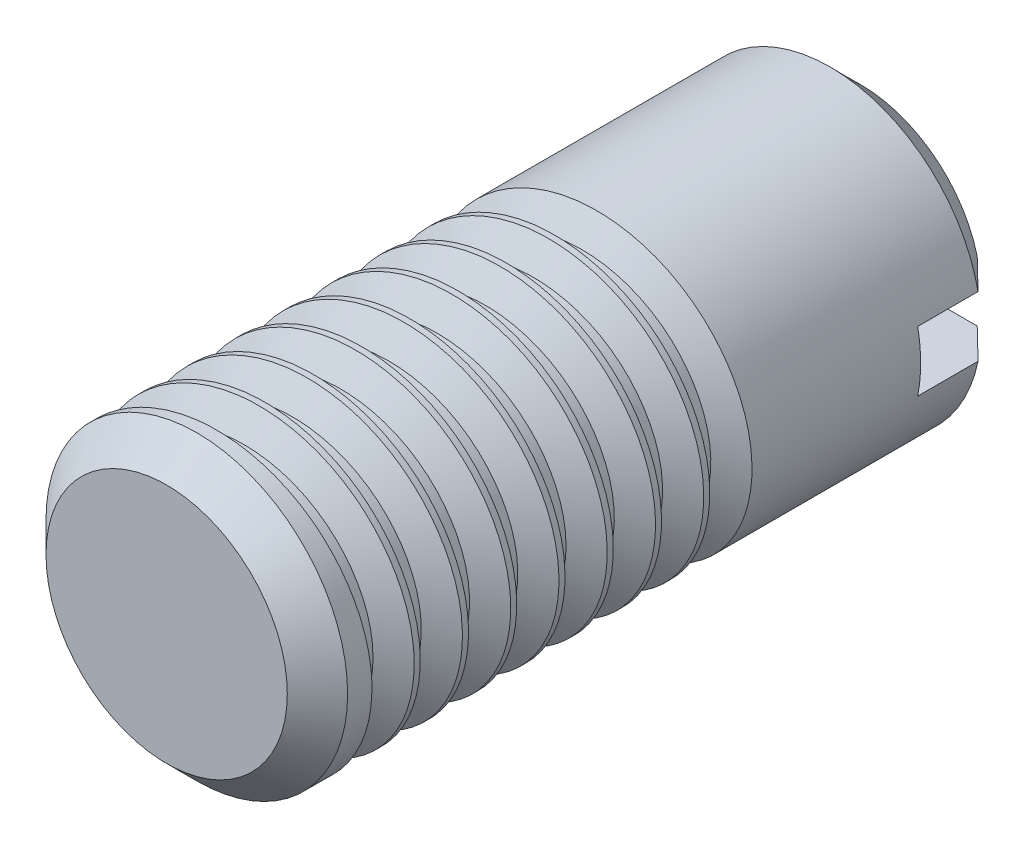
SolidWorks part; units mm, degrees
ref_plane "Front Plane" through (0, 0, 0) normal (0, 0, 1) x (1, 0, 0)
ref_plane "Top Plane" through (0, 0, 0) normal (0, 1, 0) x (1, 0, 0)
ref_plane "Right Plane" through (0, 0, 0) normal (1, 0, 0) x (0, 0, -1)
sketch "Esquisse1" plane through (0, 0, 0) normal (0, 0, 1) x (1, 0, 0)
  circle A0 centre (0, 0) radius 2.5
  dimension "D1" = 5
extrude "Boss.-Extru.1" add sketch "Esquisse1" along normal blind 11.5
chamfer "Chanfrein1" distance 0.5 angle 45 2 edges at (2.5, 0, 0) (2.5, 0, 11.5)
thread "Filetage1" pitch 0.8 start angle 0, offset 0, length 6.5, pitch 0.8, diameter 5
ref_plane "Plan1" through (-2.5, 0, 11) normal (0, -1, 0) x (-1, 0, 0)
sketch "Profil de filetage1" plane through (-2.5, 0, 11) normal (0, -1, 0) x (-1, 0, 0)
  line L0 (0, 0) -> (0, 0.8) construction
  line L11 (0, 0) -> (0, 0.7)
  line L12 (0, 0.7) -> (-0.433, 0.45)
  line L13 (-0.433, 0.45) -> (-0.433, 0.25)
  line L15 (-0.433, 0.25) -> (0, 0)
  line L17 (-0.433, 0.35) -> (0, 0.35) construction
  point P2 (0, 0)
  dimension "Pitch" = 0.8
  dimension "Profile_Angle" = 60
  dimension "Profile_Land" = 0.2
  dimension "Profile_Height" = 0.433
sketch "Esquisse7" plane through (0, 0, 0) normal (0, 0, -1) x (-1, 0, 0)
  line L0 (-2.5, 0) -> (2.5, 0) construction
  line L1 (-2.5, -0.5) -> (2.5, -0.5)
  line L2 (-2.5, 0.5) -> (2.5, 0.5)
  line L3 (2.5, 0.5) -> (2.5, -0.5)
  line L4 (-2.5, 0.5) -> (-2.5, -0.5)
  circle A0 centre (0, 0) radius 2.5 construction
  dimension "D1" = 0.5
  dimension "D2" = 0.5
extrude "Enlèv. mat.-Extru.1" cut sketch "Esquisse7" against normal blind 1.5
